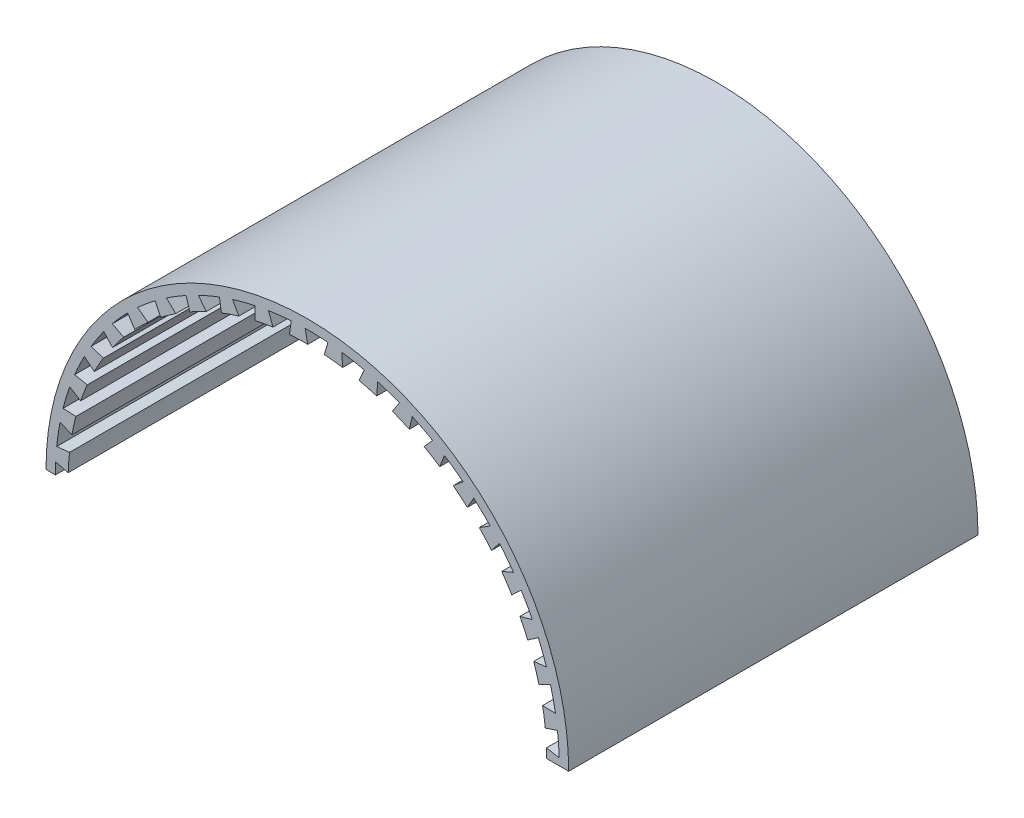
SolidWorks part; units mm, degrees
ref_plane "Plan1" through (0, 0, 0) normal (0, 0, 1) x (1, 0, 0)
ref_plane "Plan2" through (0, 0, 0) normal (0, 1, 0) x (1, 0, 0)
ref_plane "Plan3" through (0, 0, 0) normal (1, 0, 0) x (0, 0, -1)
sketch "Esquisse1" plane through (0, 0, 0) normal (0, 0, 1) x (1, 0, 0)
  line L0 (35.0008, 14.7967) -> (36.6727, 15.9723) construction
  line L1 (35.0008, 14.7967) -> (36.6727, 15.9723)
  line L2 (35.7356, 17.9713) -> (33.7625, 17.4383) construction
  line L3 (35.7356, 17.9713) -> (33.7625, 17.4383)
  line L5 (37.9714, 12.5766) -> (39.3954, 13.0482)
  line L7 (35.7356, 17.9713) -> (37.0757, 18.6452)
  arc A0 (37.9714, 12.5766) -> (36.6727, 15.9723) centre (0, 0) ccw construction
  arc A1 (37.9714, 12.5766) -> (36.6727, 15.9723) centre (0, 0) ccw
  arc A2 (35.0008, 14.7967) -> (33.7625, 17.4383) centre (0, 0) ccw construction
  arc A3 (35.0008, 14.7967) -> (33.7625, 17.4383) centre (0, 0) ccw
  arc A4 (39.3954, 13.0482) -> (37.0757, 18.6452) centre (0, 0) ccw
  dimension "D1" = 83
extrude "Base-Extrusion" add sketch "Esquisse1" against normal up to surface (65 mm away)
pattern_circular "Répétition circulaire1" count 43 over 360
sketch "Esquisse2" plane through (0, 0, 0) normal (0, -1, 0) x (1, 0, 0)
  line L1 (-110, -140) -> (90, -140)
  line L2 (-110, -140) -> (-110, 60)
  line L3 (-110, 60) -> (90, 60)
  line L4 (90, -140) -> (90, 60)
extrude "Enlèv. mat.-Extru.1" cut sketch "Esquisse2" along normal blind 105
